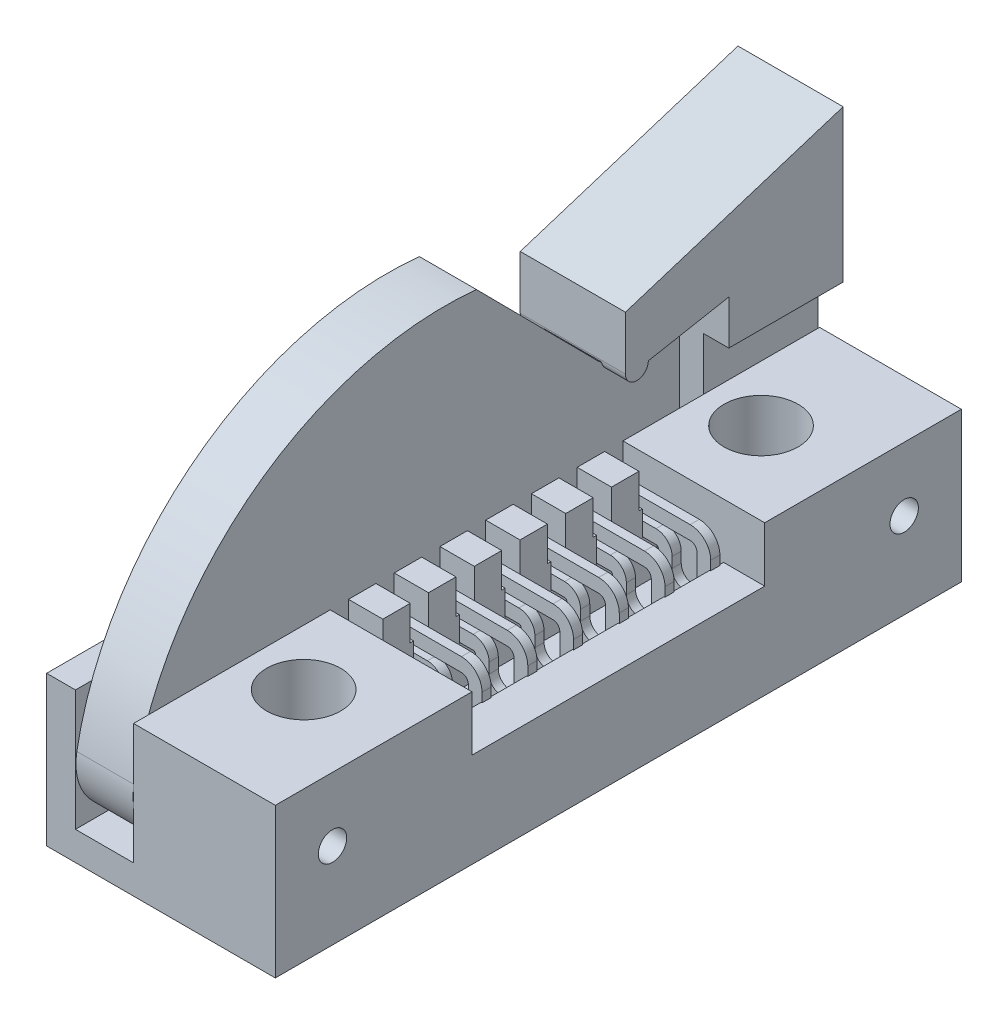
SolidWorks part; units mm, degrees
ref_plane "Front Plane" through (0, 0, 0) normal (0, 0, 1) x (1, 0, 0)
ref_plane "Top Plane" through (0, 0, 0) normal (0, 1, 0) x (1, 0, 0)
ref_plane "Right Plane" through (0, 0, 0) normal (1, 0, 0) x (0, 0, -1)
imported_body "Azimuth 5A Reversed, 5250-100W-7S-2-surface1"
imported_body "Azimuth 5A Pin-1-surface1"
imported_body "Azimuth 5A Pin-2-surface1"
imported_body "Azimuth 5A Pin-3-surface1"
imported_body "Azimuth 5A Pin-4-surface1"
imported_body "Azimuth 5A Pin-5-surface1"
imported_body "Azimuth 5A Pin-6-surface1"
imported_body "Azimuth 5A Pin-7-surface1"
imported_body "Azimuth Latch-1-surface1"
imported_body "Azimuth Clip-1-surface1"
move or copy body "Body-Move/Copy1" [suppressed] bodies to move or copy 110 copy no rotation origin (0, -1.5875, 15.875) rotation axis (1, 0, 0) rotation angle 115
move or copy body "Body-Move/Copy2" [suppressed] bodies to move or copy 109 copy no rotation origin (0, -1.5875, -15.875) rotation axis (-1, 0, 0) rotation angle 90
ref_plane "Plane1" through (0, -9.525, 0) normal (0, -1, 0) x (1, 0, 0)
surface "Surface-Trim1"
surface "Surface-Fill1"
surface "Surface-Fill2"
